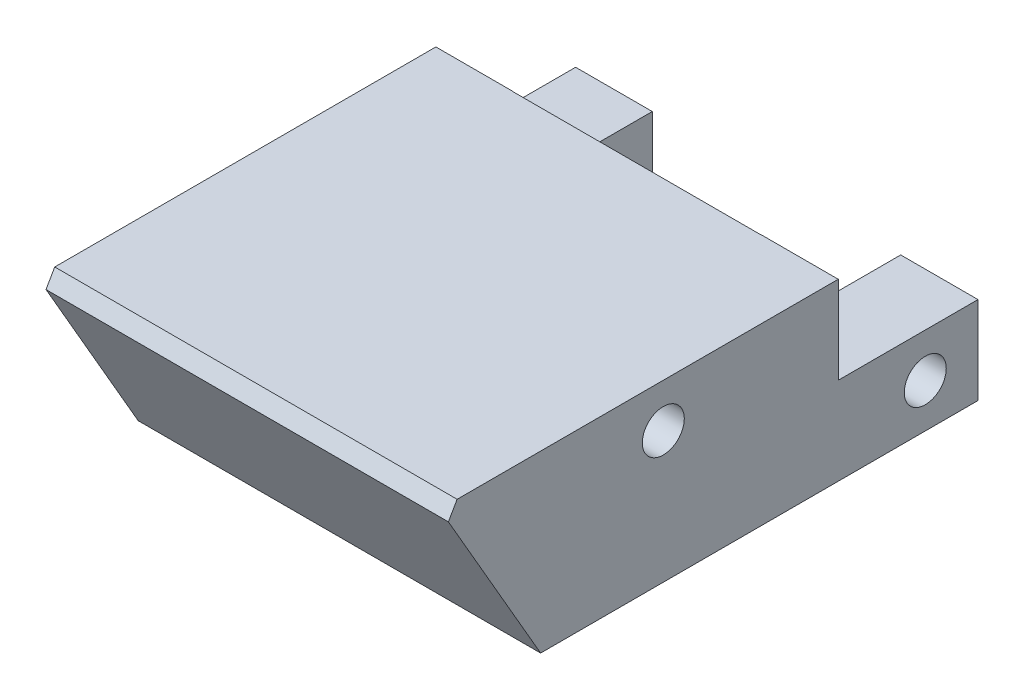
SolidWorks part; units mm, degrees
ref_plane "Спереди" through (0, 0, 0) normal (0, 0, 1) x (1, 0, 0)
ref_plane "Сверху" through (0, 0, 0) normal (0, 1, 0) x (1, 0, 0)
ref_plane "Справа" through (0, 0, 0) normal (1, 0, 0) x (0, 0, -1)
sketch "Эскиз2" plane through (0, 0, 0) normal (0, 1, 0) x (1, 0, 0)
  line L1 (-2.8488, 3.5096) -> (20.1512, 3.5096)
  line L2 (-2.8488, 3.5096) -> (-2.8488, -21.4904)
  line L3 (-2.8488, -21.4904) -> (20.1512, -21.4904)
  line L4 (20.1512, 3.5096) -> (20.1512, -21.4904)
  line L6 (1.5335, 3.5096) -> (1.5335, -4.4904)
  line L7 (1.5335, -4.4904) -> (15.7335, -4.4904)
  line L8 (15.7335, 3.5096) -> (15.7335, -4.4904)
  dimension "D1" = 23
  dimension "D2" = 25
  dimension "D3" = 14.2
  dimension "D4" = 8
extrude "Бобышка-Вытянуть1" add sketch "Эскиз2" along normal blind 10 contours L1 L8 L7 L6 L2 L3 L4
sketch "Эскиз3" plane through (0, 10, 0) normal (0, 1, 0) x (1, 0, 0)
  line L0 (20.1512, 3.5096) -> (20.1512, -21.4904) construction
  line L1 (-2.8488, 3.5096) -> (20.1512, 3.5096)
  line L2 (-2.8488, 3.5096) -> (-2.8488, -4.4785)
  line L3 (-2.8488, -4.4785) -> (20.1512, -4.4785)
  line L4 (20.1512, 3.5096) -> (20.1512, -4.4785)
extrude "Вырез-Вытянуть1" cut sketch "Эскиз3" against normal blind 5
sketch "Эскиз4" plane through (20.1512, 0, 0) normal (1, 0, 0) x (0, 0, -1)
  circle A0 centre (0.4954, 2.5) radius 1.2
extrude "Вырез-Вытянуть3" cut sketch "Эскиз4" against normal blind 30
draft "Уклон2" type of draft neutral plane draft angle 30 faces to draft 1 parameters "D1"=30
sketch "Эскиз6" plane through (-2.8488, 0, 0) normal (-1, 0, 0) x (0, 0, 1)
  circle A0 centre (14.4785, 7.5) radius 1.2
extrude "Вырез-Вытянуть4" cut sketch "Эскиз6" against normal blind 30
chamfer "Фаска1" distance 1 distance2 1 1 edges at (8.6512, 10, 27.2639)
